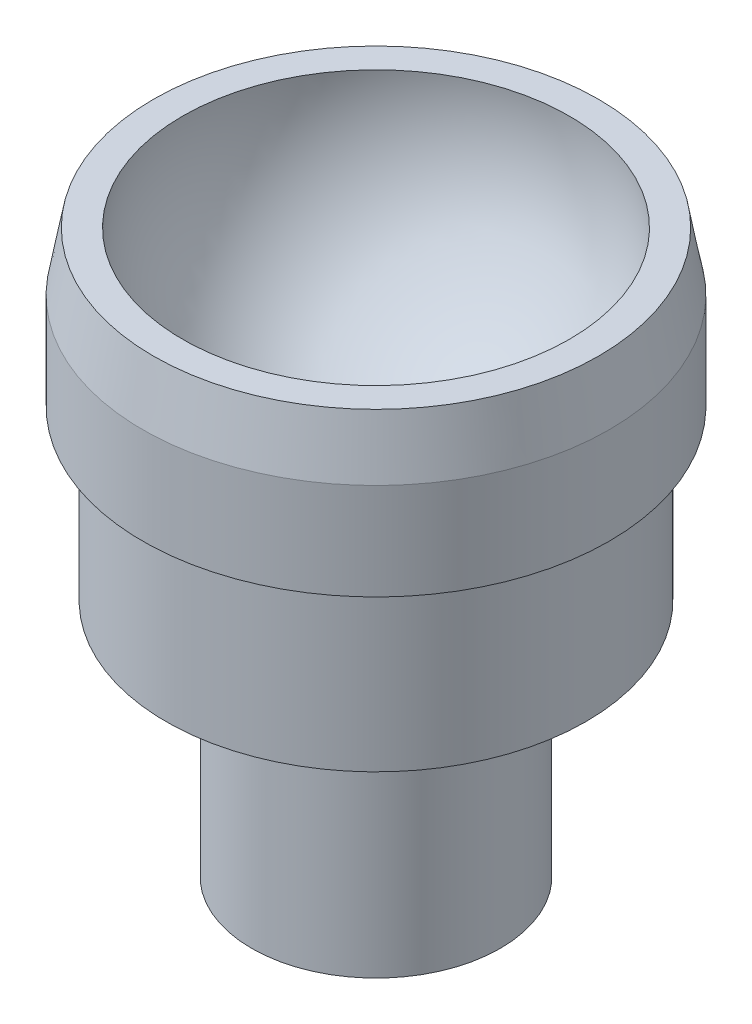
SolidWorks part; units mm, degrees
ref_plane "Plan de face" through (0, 0, 0) normal (0, 0, 1) x (1, 0, 0)
ref_plane "Plan de dessus" through (0, 0, 0) normal (0, 1, 0) x (1, 0, 0)
ref_plane "Plan de droite" through (0, 0, 0) normal (1, 0, 0) x (0, 0, -1)
sketch "Esquisse1" plane through (0, 0, 0) normal (0, 0, 1) x (1, 0, 0)
  line L0 (0, 7) -> (0, -16)
  line L1 (0, -16) -> (6.9173, -16)
  line L2 (6.9173, -16) -> (8, -15.3749)
  line L3 (8, -15.3749) -> (8, -2.2251)
  line L4 (8, -2.2251) -> (6.9173, -1.6)
  line L5 (6.9173, -1.6) -> (6.9173, 0)
  line L6 (6.9173, 0) -> (13.5, 0)
  line L7 (13.5, 0) -> (13.5, 10.8)
  line L8 (13.5, 10.8) -> (15, 10.8)
  line L9 (15, 10.8) -> (15, 17.01)
  line L10 (15, 17.01) -> (14.3091, 20.76)
  line L11 (14.3091, 20.76) -> (12.4363, 20.76)
  line L12 (0, 20.76) -> (0, -16) construction
  arc A0 (12.4363, 20.76) -> (0, 7) centre (0, 19.5) cw
revolve "Révolution1" add sketch "Esquisse1" angle 360 about L12
